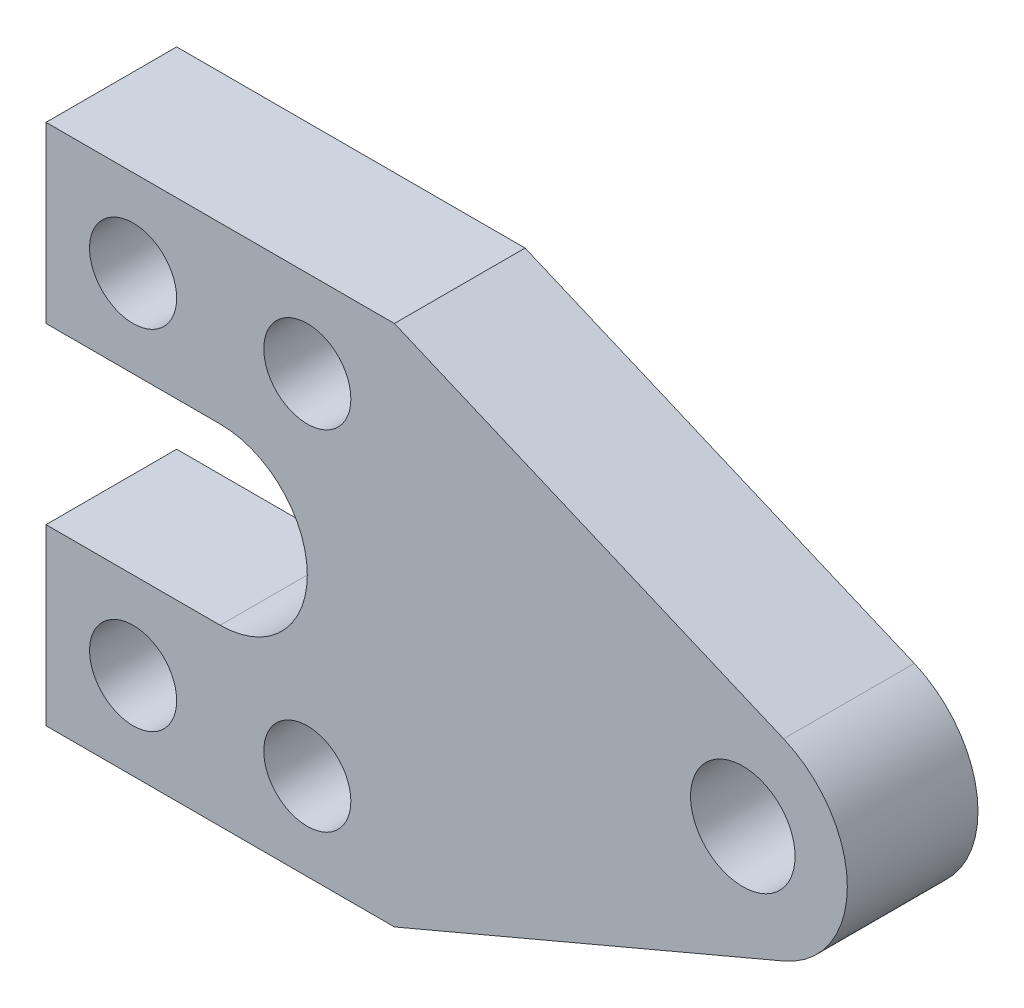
SolidWorks part; units mm, degrees
ref_plane "Front Plane" through (0, 0, 0) normal (0, 0, 1) x (1, 0, 0)
ref_plane "Top Plane" through (0, 0, 0) normal (0, 1, 0) x (1, 0, 0)
ref_plane "Right Plane" through (0, 0, 0) normal (1, 0, 0) x (0, 0, -1)
sketch "Sketch1" plane through (0, 0, 0) normal (0, 0, 1) x (1, 0, 0)
  line L0 (10, 50) -> (30, 50)
  line L1 (30, 40) -> (143.1123, 40) construction
  line L2 (10, 30) -> (30, 30)
  line L3 (10, 50) -> (10, 70)
  line L4 (10, 70) -> (50, 70)
  line L5 (50, 70) -> (94.6856, 51.0474)
  line L6 (94.6856, 28.9526) -> (50, 10)
  line L7 (50, 10) -> (10, 10)
  line L8 (10, 10) -> (10, 30)
  arc A0 (30, 30) -> (30, 50) centre (30, 40) ccw
  arc A1 (94.6856, 51.0474) -> (94.6856, 28.9526) centre (90, 40) cw
  circle A2 centre (90, 40) radius 6
  circle A3 centre (20, 20) radius 5
  circle A4 centre (20, 60) radius 5
  circle A5 centre (40, 60) radius 5
  circle A6 centre (40, 20) radius 5
  dimension "D1" = 10
  dimension "D7" = 12
  dimension "D8" = 12
  dimension "D14" = 10
  dimension "D2" = 60
  dimension "D3" = 40
  dimension "D4" = 80
  dimension "D5" = 10
  dimension "D6" = 10
  dimension "D9" = 20
  dimension "D10" = 40
  dimension "D11" = 20
  dimension "D12" = 10
  dimension "D13" = 10
extrude "Boss-Extrude1" add sketch "Sketch1" along normal blind 15
sketch "Sketch2" plane through (0, 0, 15) normal (0, 0, 1) x (1, 0, 0)
  line L0 (10, 30) -> (10, 10) construction
  line L1 (10, 10) -> (50, 10) construction
  circle A0 centre (20, 20) radius 5
  dimension "D3" = 10
  dimension "D1" = 10
  dimension "D2" = 10
extrude "Cut-Extrude1" cut sketch "Sketch2" against normal blind 15
pattern_linear "LPattern1" count 2 spacing 40 count 2 spacing 20
